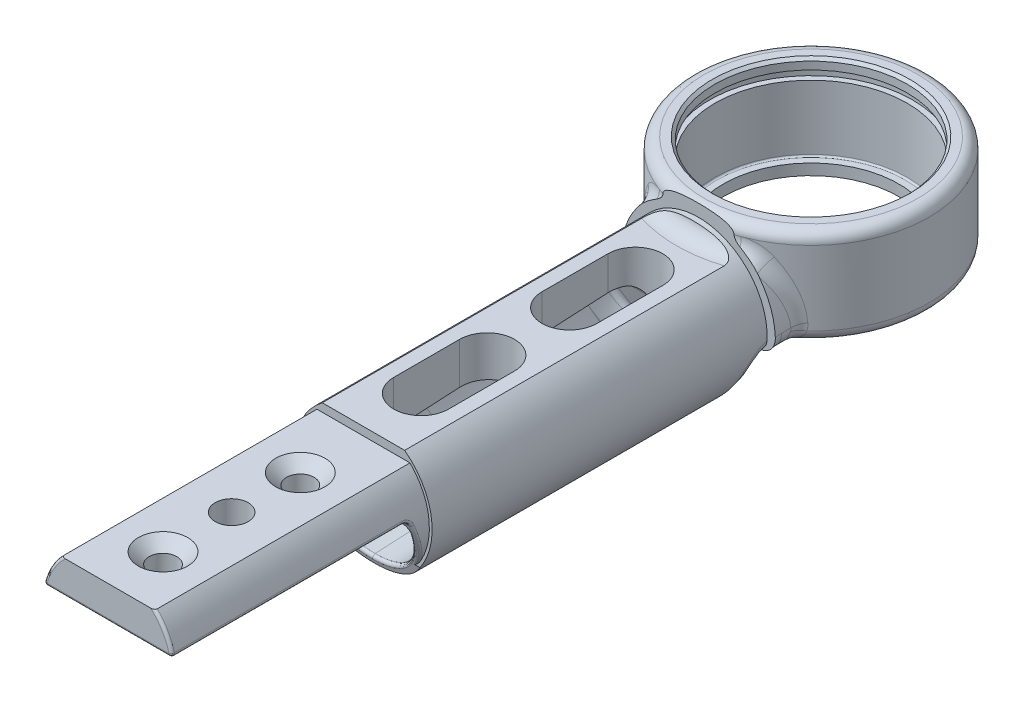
SolidWorks part; units mm, degrees
ref_plane "Face" through (0, 0, 0) normal (0, 0, 1) x (1, 0, 0)
ref_plane "Dessus" through (0, 0, 0) normal (0, 1, 0) x (1, 0, 0)
ref_plane "Droite" through (0, 0, 0) normal (1, 0, 0) x (0, 0, -1)
sketch "Esquisse1" plane through (0, 0, 0) normal (0, 0, 1) x (1, 0, 0)
  line L0 (0, 24.1296) -> (0, -24.1296) construction
  line L2 (0, 8.75) -> (19.5, 8.75)
  line L3 (0, 8.75) -> (0, -8.75)
  line L4 (0, -8.75) -> (19.5, -8.75)
  line L5 (21.5, 6.75) -> (21.5, -6.75)
  arc A0 (21.5, 6.75) -> (19.5, 8.75) centre (19.5, 6.75) ccw
  arc A1 (19.5, -8.75) -> (21.5, -6.75) centre (19.5, -6.75) ccw
  point P11 (21.5, 8.75)
  point P14 (21.5, -8.75)
  dimension "D4" = 2
  dimension "D2" = 43
  dimension "D3" = 17.5
revolve "Révolution1" add sketch "Esquisse1" angle 360 about L0
ref_plane "Plan1" through (0, 0, 128) normal (0, 0, 1) x (1, 0, 0)
sketch "Esquisse2" plane through (0, 0, 128) normal (0, 0, 1) x (1, 0, 0)
  line L0 (-9.798, 3.75) -> (9.798, 3.75)
  line L1 (0, 0) -> (0, 3.75) construction
  line L2 (19.5, 8.75) -> (-19.5, 8.75) construction
  line L3 (-19.5, -8.75) -> (19.5, -8.75) construction
  arc A0 (9.798, 3.75) -> (-9.798, 3.75) centre (0, -6.25) cw
  dimension "D2" = 15
  dimension "D3" = 14
  dimension "D1" = 5
  dimension "D4" = 2.5
extrude "Extrusion1" add sketch "Esquisse2" against normal up to vertex
sketch "Esquisse3" plane through (0, 0, 0) normal (1, 0, 0) x (0, 0, -1)
  line L0 (0, -8.75) -> (-21.5, -8.75)
  line L1 (-21.5, -8.75) -> (-26.0496, -21.25)
  line L2 (-26.0496, -21.25) -> (-78.6305, -21.25)
  line L3 (-78.6305, -21.25) -> (-85, -3.75)
  line L5 (-13.8022, -8.75) -> (19.5, -8.75) construction
  line L6 (0, 0) -> (0, -40.8693) construction
  line L7 (-85, -3.75) -> (-85, -32.5011) construction
  line L8 (19.5, 8.75) -> (-19.5, 8.75) construction
  line L9 (-73.1223, -6.25) -> (-30.9097, -6.25) construction
  line L10 (-128, -3.75) -> (-85, -3.75)
  line L11 (-128, -20.25) -> (0, -20.25) construction
  line L12 (-128, 3.75) -> (-128, -20.25) construction
  dimension "D1" = 20
  dimension "D2" = 21.5
  dimension "D3" = 20
  dimension "D4" = 85
  dimension "D5" = 1
  dimension "D6" = 2.5
  dimension "D7" = 15
  dimension "D8" = 15
extrude "Enlèv. mat.-Extru.1" cut sketch "Esquisse3" against normal through all and the other way through all
fillet "Congé1" radius 3 4 edges at (13.775, -8.75, 17.6511) (-13.775, -8.75, 17.6511) (0, -20.25, 25.6857) (0, -8.75, 21.5)
fillet "Congé2" radius 3 9 edges at (-12.8992, -8.063, 16.5824) (-13.9797, -5.981, 16.3345) (12.8992, -8.063, 16.5824) (13.9161, -6.4058, 16.3888) (-13.3103, -1.9101, 16.8845) (12.5642, -0.0741, 17.4468) (0, 3.75, 21.5) (9.798, 3.75, 73.5688) (-9.798, 3.75, 73.5688)
sketch "Esquisse8" plane through (0, 0, 128) normal (0, 0, 1) x (1, 0, 0)
  line L0 (19.5, 8.75) -> (-19.5, 8.75) construction
  circle A0 centre (0, -6.25) radius 12.5
  dimension "D1" = 25
  dimension "D2" = 15
extrude "Enlèv. mat.-Extru.2" cut sketch "Esquisse8" against normal blind 107.5 flip side to cut
sketch "Esquisse9" plane through (0, 0, 128) normal (0, 0, 1) x (1, 0, 0)
  line L0 (-8.4705, 2.25) -> (8.4705, 2.25)
  line L1 (0, 0) -> (0, 2.25) construction
  line L2 (7.5, 3.75) -> (-7.5, 3.75) construction
  arc A0 (8.4705, 2.25) -> (-8.4705, 2.25) centre (0, -6.25) cw
  arc A1 (12.2474, -3.75) -> (7.5, 3.75) centre (0, -6.25) ccw construction
  dimension "D2" = 24
  dimension "D1" = 1.5
extrude "Enlèv. mat.-Extru.3" cut sketch "Esquisse9" against normal blind 46.5 flip side to cut
sketch "Esquisse10" plane through (0, -27.7571, 76.2621) normal (0, -0.342, 0.9397) x (1, 0, 0)
  line L0 (0, 0) -> (0, 29.2597) construction
  line L1 (-11, 24.0479) -> (11, 24.0479)
  line L2 (11.7367, 25.5479) -> (-11.7367, 25.5479) construction
  ellipse E0 centre (0, 24.0479) end of major axis (0, 11.0479) minor radius 11 (-11, 24.0479) -> (11, 24.0479) ccw
  ellipse E3 centre (0, 22.0016) end of major axis (-12.5, 22.0016) minor radius 11.7462 (10.2767, 15.3145) -> (7.5, 31.3985) ccw construction
  dimension "D1" = 11
  dimension "D2" = 13
  dimension "D3" = 1.5
ref_plane "Plan2" through (0, -9.2881, 25.5187) normal (0, -0.342, 0.9397) x (1, 0, 0)
ref_plane "Plan3" through (0, -3.75, 0) normal (0, 1, 0) x (-1, 0, 0)
sketch "Esquisse11" plane through (0, 0, 0) normal (1, 0, 0) x (0, 0, -1)
  line L0 (-80.0407, -17.3755) -> (-57.0889, -16.1727)
  line L2 (-57.0889, -16.1727) -> (-27.0889, -16.1727)
  line L4 (-35.7592, 18.8473) -> (-15.2783, -37.4234) construction
  line L5 (-27.0889, -16.1727) -> (-24.5889, -11.8426)
  dimension "D1" = 3
  dimension "D2" = 120
  dimension "D3" = 30
  dimension "D4" = 5
sketch "Esquisse12" plane through (0, 0, 0) normal (1, 0, 0) x (0, 0, -1)
  line L0 (-84.487, -5.1595) -> (-28.097, -2.2043)
  line L2 (-35.7592, 18.8473) -> (-15.2783, -37.4234) construction
  line L3 (-76.2621, -27.7571) -> (-86.2695, -0.262) construction
  dimension "D1" = 73
sketch "Esquisse14" plane through (0, -9.2881, 25.5187) normal (0, -0.342, 0.9397) x (1, 0, 0)
  line L0 (-10.2569, 7.5384) -> (10.2569, 7.5384)
  arc A0 (-10.2569, 7.5384) -> (10.2569, 7.5384) centre (0, 7.5384) ccw
  dimension "D1" = 20.5137
sketch "Esquisse13" plane through (0, -3.75, 0) normal (0, 1, 0) x (-1, 0, 0)
  line L0 (11, 84.487) -> (10.1241, 27.5344)
  line L1 (11, 84.487) -> (11, 26.1499) construction
sketch "Esquisse21" plane through (0, -3.75, 0) normal (0, 1, 0) x (-1, 0, 0)
  line L0 (0, 0) -> (0, 138.9338) construction
  line L1 (11, 84.487) -> (10.1241, 27.5344) construction
  line L2 (11, 84.487) -> (10.1241, 27.5344) construction
  line L3 (-11, 84.487) -> (-10.1241, 27.5344)
loft "Enlèvement de matière-Lissage1" cut profiles "Esquisse10", "Esquisse14"
sketch "Esquisse16" plane through (0, 0, 0) normal (1, 0, 0) x (0, 0, -1)
  line L0 (0, 18.3448) -> (0, -39.8778) construction
  line L1 (0, 9.75) -> (17.5, 9.75)
  line L2 (17.5, 9.75) -> (17.5, 6.85)
  line L3 (17.5, 6.85) -> (18.5, 6.85)
  line L4 (18.5, 6.85) -> (18.5, 5.25)
  line L5 (18.5, 5.25) -> (17.5, 5.25)
  line L6 (17.5, 5.25) -> (17.5, -6.75)
  line L7 (17.5, -6.75) -> (16, -6.75)
  line L8 (16, -6.75) -> (16, -9.75)
  line L9 (16, -9.75) -> (0, -9.75)
  line L10 (0, 9.75) -> (0, -9.75)
  line L11 (-16.109, -8.75) -> (19.5, -8.75) construction
  line L12 (19.5, 8.75) -> (-19.5, 8.75) construction
  dimension "D1" = 1
  dimension "D2" = 1
  dimension "D3" = 32
  dimension "D4" = 35
  dimension "D5" = 37
  dimension "D6" = 1.6
  dimension "D7" = 13.6
  dimension "D8" = 2
revolve "Enlèvement de matière-Révolution1" cut sketch "Esquisse16" angle 360 about L0
sketch "Esquisse17" plane through (0, 2.25, 0) normal (0, 1, 0) x (-1, 0, 0)
  line L0 (0, 0) -> (0, 131.6552) construction
  circle A0 centre (0, 105.5) radius 3
  point P5 (0, 118)
  point P6 (0, 93)
  dimension "D1" = 6
  dimension "D4" = 12.5
  dimension "D2" = 93
  dimension "D3" = 12.5
extrude "Enlèv. mat.-Extru.5" cut sketch "Esquisse17" against normal through all
hole_wizard "Trou taraudé M6x1.01" positions "Esquisse3D1" profile "Esquisse18" tap size "M6x1.0" standard "ISO"
sketch3d "Esquisse3D1"
  point P0 (0, 2.25, 93)
  point P2 (0, 2.25, 118)
sketch "Esquisse18" plane through (0, 2.25, 93) normal (1, 0, 0) x (0, 0, 1)
  line L0 (0, 0) -> (0, 21)
  line L1 (0, 21) -> (2.5, 21)
  line L2 (2.5, 21) -> (2.5, 0)
  line L5 (2.5, 0) -> (0, 0)
  line L11 (0, -6.35) -> (0, 107.95) construction
  dimension "Diamètre du trou pour taraudage jusqu'au prochain" = 5
  dimension "Profondeur du trou pour taraudage jusqu'au prochain" = 21
sketch "Esquisse19" plane through (0, 3.75, 0) normal (0, 1, 0) x (-1, 0, 0)
  line L0 (-5, 59) -> (-5, 71)
  line L1 (5, 71) -> (5, 59)
  line L2 (-5, 32) -> (-5, 44)
  line L3 (5, 44) -> (5, 32)
  line L4 (0, 89.2211) -> (0, -23.2011) construction
  arc A0 (-5, 71) -> (5, 71) centre (0, 71) cw
  arc A1 (5, 59) -> (-5, 59) centre (0, 59) cw
  arc A2 (-5, 44) -> (5, 44) centre (0, 44) cw
  arc A3 (5, 32) -> (-5, 32) centre (0, 32) cw
  circle A4 centre (0, 93) radius 2.5 construction
  dimension "D1" = 5
  dimension "D2" = 12
  dimension "D3" = 12
  dimension "D4" = 15
  dimension "D5" = 22
extrude "Enlèv. mat.-Extru.6" cut sketch "Esquisse19" against normal blind 15
chamfer "Chanfrein1" distance 2 angle 45 2 edges at (0, 2.25, 120.5) (0, 2.25, 95.5)
fillet "Congé10" radius 0.3 1 edges at (0, -6.75, 17.5)
chamfer "Chanfrein2" distance 0.5 angle 45 1 edges at (17.5, 8.75, 0)
fillet "Congé12" radius 2 3 edges at (-12.0186, -9.6857, 21.8726) (12.1374, -9.2388, 21.4411) (1.768, -18.6243, 25.1447)
fillet "Congé13" radius 1.5 1 edges at (0, -3.75, 85)
fillet "Congé14" radius 2 4 edges
fillet "Congé15" radius 1 8 edges at (10.0964, -4.2267, 30.3188) (10.4779, -4.3346, 50.6088) (10.5966, -4.5104, 58.2599) (-10.0734, -4.2333, 29.3506) (-10.2251, -4.2104, 36.3175) (-10.5966, -4.5104, 58.2599)
fillet "Congé16" radius 1 12 edges at (9.2147, -2.5961, 28.3895) (-9.2147, -2.5961, 28.3895)
fillet "Congé17" radius 0.5 7 edges at (-10.7705, -5.5604, 84.3411) (10.5684, -5.3581, 84.4147)
fillet "Congé18" radius 0.5 9 edges at (11.6144, -9.2675, 82.9918) (-11.6144, -9.2675, 82.9918) (11.8, -4.0683, 85.1264) (-11.7804, -3.9649, 85.2767) (-11.7367, -3.75, 107.0252) (11.7367, -3.75, 107.0252) (0, -3.75, 128) (-10.5396, -0.5127, 128) (10.5396, -0.5127, 128)
